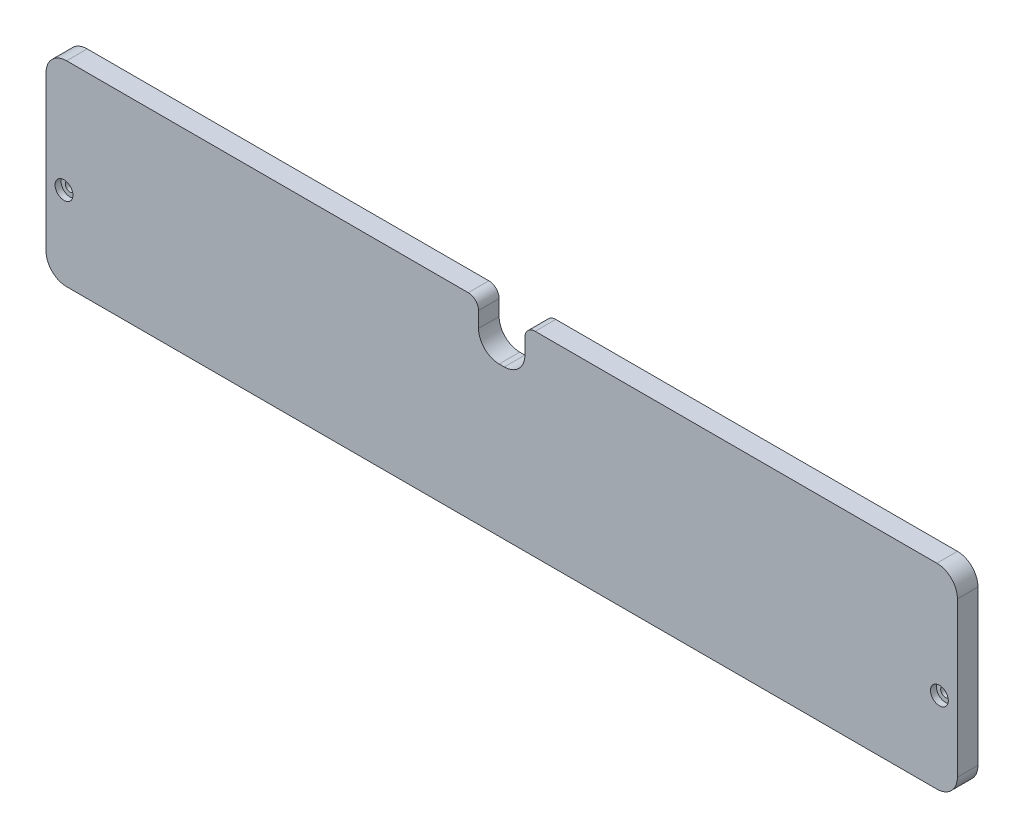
SolidWorks part; units mm, degrees
ref_plane "Front Plane" through (0, 0, 0) normal (0, 0, 1) x (1, 0, 0)
ref_plane "Top Plane" through (0, 0, 0) normal (0, 1, 0) x (1, 0, 0)
ref_plane "Right Plane" through (0, 0, 0) normal (1, 0, 0) x (0, 0, -1)
sketch "Sketch1" plane through (0, 0, 0) normal (0, 0, 1) x (1, 0, 0)
  line L0 (12.7, 0) -> (549.275, 0)
  line L1 (561.975, 12.7) -> (561.975, 107.95)
  line L2 (549.275, 120.65) -> (301.625, 120.65)
  line L3 (295.275, 114.3) -> (295.275, 104.775)
  line L4 (282.575, 92.075) -> (279.4, 92.075)
  line L5 (266.7, 104.775) -> (266.7, 114.3)
  line L6 (260.35, 120.65) -> (12.7, 120.65)
  line L7 (0, 107.95) -> (0, 12.7)
  arc A0 (0, 12.7) -> (12.7, 0) centre (12.7, 12.7) ccw
  arc A1 (549.275, 0) -> (561.975, 12.7) centre (549.275, 12.7) ccw
  arc A2 (561.975, 107.95) -> (549.275, 120.65) centre (549.275, 107.95) ccw
  arc A3 (12.7, 120.65) -> (0, 107.95) centre (12.7, 107.95) ccw
  arc A4 (282.575, 92.075) -> (295.275, 104.775) centre (282.575, 104.775) ccw
  arc A5 (279.4, 92.075) -> (266.7, 104.775) centre (279.4, 104.775) cw
  arc A6 (301.625, 120.65) -> (295.275, 114.3) centre (301.625, 114.3) ccw
  arc A7 (266.7, 114.3) -> (260.35, 120.65) centre (260.35, 114.3) ccw
  point P11 (0, 0)
  point P14 (561.975, 0)
  point P17 (561.975, 120.65)
  point P20 (0, 120.65)
  point P23 (295.275, 92.075)
  point P28 (295.275, 120.65)
  point P31 (266.7, 120.65)
  dimension "D6" = 12.7
  dimension "D7" = 12.7
  dimension "D8" = 6.35
  dimension "D1" = 561.975
  dimension "D2" = 266.7
  dimension "D3" = 266.7
  dimension "D4" = 120.65
  dimension "D5" = 28.575
extrude "Boss-Extrude1" add sketch "Sketch1" along normal blind 12.7
hole_wizard "CBORE for M5 Pan Head Machine Screw1" positions "Sketch3" profile "Sketch2" counterbore size "M5" standard "ANSI Metric"
sketch "Sketch3" plane through (0, 0, 12.7) normal (0, 0, 1) x (1, 0, 0)
  line L0 (12.7, 0) -> (549.275, 0) construction
  line L3 (282.575, 92.075) -> (279.4, 92.075) construction
  point P0 (11.1125, 50.8)
  point P2 (550.8625, 50.8)
  point P14 (280.9875, 92.075)
  point P17 (280.9875, 92.075)
  dimension "D1" = 50.8
  dimension "D2" = 269.875
  dimension "D3" = 269.875
sketch "Sketch2" plane through (11.1125, 50.8, 12.7) normal (1, 0, 0) x (0, -1, 0)
  line L0 (0, 0) -> (0, 12.7)
  line L1 (0, 12.7) -> (2.9, 12.7)
  line L3 (2.9, 12.7) -> (2.9, 3.7)
  line L4 (2.9, 3.7) -> (5.5, 3.7)
  line L5 (5.5, 3.7) -> (5.5, 0)
  line L7 (5.5, 0) -> (0, 0)
  line L11 (0, -6.35) -> (0, 107.95) construction
  dimension "Thru Hole Dia." = 5.8
  dimension "Thru Hole Depth" = 12.7
  dimension "C'Bore Dia." = 11
  dimension "C'Bore Depth" = 3.7
